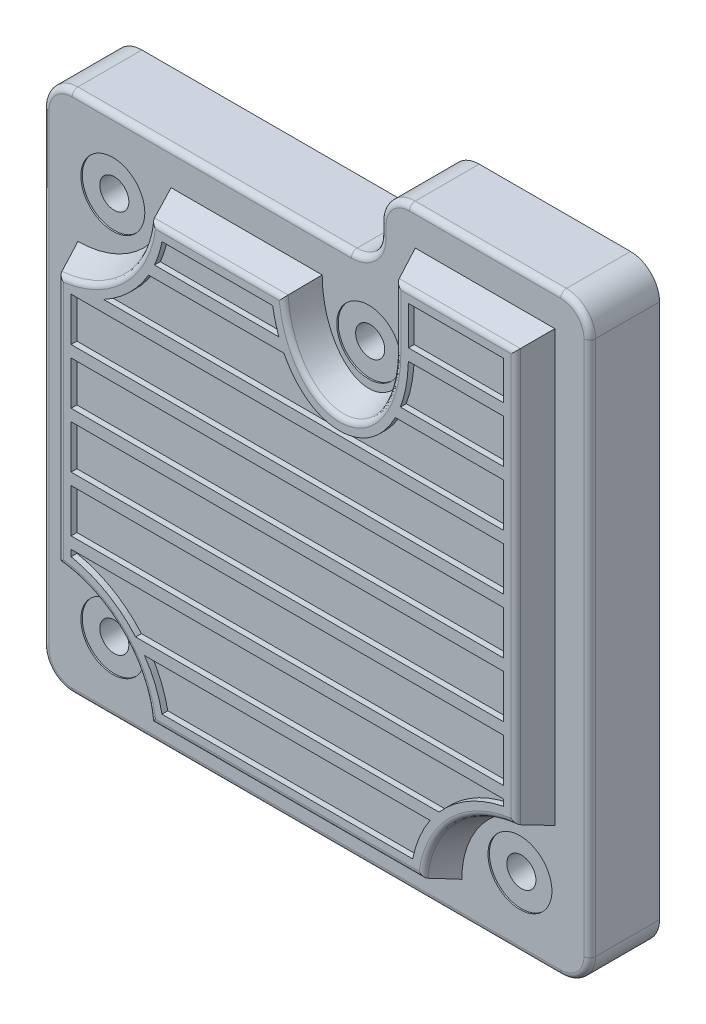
SolidWorks part; units mm, degrees
ref_plane "Plan de face" through (0, 0, 0) normal (0, 0, 1) x (1, 0, 0)
ref_plane "Plan de dessus" through (0, 0, 0) normal (0, 1, 0) x (1, 0, 0)
ref_plane "Plan de droite" through (0, 0, 0) normal (1, 0, 0) x (0, 0, -1)
sketch "Esquisse1" plane through (0, 0, 0) normal (0, 0, 1) x (1, 0, 0)
  line L0 (0, 0) -> (0, 90)
  line L1 (0, 90) -> (58, 90)
  line L2 (58, 90) -> (58, 102)
  line L3 (58, 102) -> (94, 102)
  line L4 (94, 102) -> (94, 0)
  line L5 (94, 0) -> (0, 0)
  dimension "D1" = 94
  dimension "D2" = 36
  dimension "D3" = 90
  dimension "D4" = 102
extrude "Boss.-Extru.1" add sketch "Esquisse1" along normal blind 12
sketch "Esquisse2" plane through (0, 0, 12) normal (0, 0, 1) x (1, 0, 0)
  line L0 (58, 90) -> (0, 90) construction
  line L1 (0, 90) -> (0, 0) construction
  line L2 (0, 0) -> (94, 0) construction
  line L3 (94, 0) -> (94, 102) construction
  circle A0 centre (12, 78) radius 5.5
  circle A1 centre (56, 78) radius 5.5
  circle A2 centre (82, 12) radius 5.5
  circle A3 centre (12, 12) radius 5.5
  dimension "D1" = 11
  dimension "D2" = 12
  dimension "D3" = 12
  dimension "D4" = 12
  dimension "D5" = 12
  dimension "D6" = 12
  dimension "D7" = 12
  dimension "D8" = 12
  dimension "D9" = 44
extrude "Enlèv. mat.-Extru.1" cut sketch "Esquisse2" against normal blind 0.25
sketch "Esquisse3" plane through (0, 0, 12) normal (0, 0, 1) x (1, 0, 0)
  circle A0 centre (12, 78) radius 2.5
  circle A1 centre (56, 78) radius 2.5
  circle A2 centre (82, 12) radius 2.5
  circle A3 centre (12, 12) radius 2.5
  dimension "D1" = 5
extrude "Enlèv. mat.-Extru.2" cut sketch "Esquisse3" against normal up to next
sketch "Esquisse4" plane through (0, 0, 12) normal (0, 0, 1) x (1, 0, 0)
  line L0 (48, 84) -> (22, 84)
  line L1 (6, 68) -> (6, 22)
  line L2 (22, 6) -> (72, 6)
  line L3 (88, 22) -> (88, 96)
  line L4 (88, 96) -> (64, 96)
  line L5 (64, 96) -> (64, 84)
  arc A0 (6, 68) -> (22, 84) centre (6, 84) ccw
  arc A1 (22, 6) -> (6, 22) centre (6, 6) ccw
  arc A2 (88, 22) -> (72, 6) centre (88, 6) ccw
  ellipse E0 centre (56, 84) end of major axis (56, 71.0914) minor radius 8 (48, 84) -> (64, 84) ccw
  point P0 (0, 0)
  point P9 (0, 0)
  point P12 (55, 70.9129)
  point P13 (0, 0)
  point P18 (56, 71.0914)
  dimension "D1" = 32
  dimension "D3" = 32
  dimension "D4" = 32
  dimension "D2" = 16
extrude "Boss.-Extru.2" add sketch "Esquisse4" along normal blind 5 draft 20
sketch "Esquisse5" plane through (0, 0, 17) normal (0, 0, 1) x (1, 0, 0)
  line L12 (9.8199, 64.5517) -> (9.8199, 25.4483)
  line L13 (25.4483, 9.8199) -> (68.5517, 9.8199)
  line L14 (84.1801, 25.4483) -> (84.1801, 92.1801)
  line L15 (84.1801, 92.1801) -> (67.8199, 92.1801)
  line L16 (67.8199, 92.1801) -> (67.8199, 84)
  line L17 (44.4807, 80.1801) -> (25.4483, 80.1801)
  line L18 (9.8199, 64.5517) -> (9.8199, 25.4483)
  line L19 (25.4483, 9.8199) -> (68.5517, 9.8199)
  line L20 (84.1801, 25.4483) -> (84.1801, 92.1801)
  line L21 (84.1801, 92.1801) -> (67.8199, 92.1801)
  line L22 (67.8199, 92.1801) -> (67.8199, 84)
  line L23 (44.4807, 80.1801) -> (25.4483, 80.1801)
  arc A6 (9.8199, 64.5517) -> (25.4483, 80.1801) centre (6, 84) ccw
  arc A7 (25.4483, 9.8199) -> (9.8199, 25.4483) centre (6, 6) ccw
  arc A8 (84.1801, 25.4483) -> (68.5517, 9.8199) centre (88, 6) ccw
  arc A9 (9.8199, 64.5517) -> (25.4483, 80.1801) centre (6, 84) ccw
  arc A10 (25.4483, 9.8199) -> (9.8199, 25.4483) centre (6, 6) ccw
  arc A11 (84.1801, 25.4483) -> (68.5517, 9.8199) centre (88, 6) ccw
  spline S2 degree 3 poles (-2824.3667, 861.4988) (-436.7816, 356.2799) (77.4702, 173.721) (67.5936, 80.5699) (67.4587, 79.7259) (67.0934, 78.0542) (66.8631, 77.2266) (66.4348, 75.9995) (66.2782, 75.5933) (65.9397, 74.7979) (65.7573, 74.4073) (65.1678, 73.2582) (64.719, 72.5223) (63.9424, 71.4742) (63.6676, 71.1366) (63.0901, 70.4946) (62.7866, 70.1891) (62.1472, 69.6117) (61.8113, 69.3398) (61.103, 68.8341) (60.7326, 68.6021) (59.9723, 68.1918) (59.5805, 68.0119) (58.974, 67.7825) (58.7687, 67.7128) (58.3515, 67.5877) (58.1392, 67.5323) (57.0791, 67.2961) (56.221, 67.2312) (55.1354, 67.3117) (54.9173, 67.3361) (54.487, 67.4002) (54.2741, 67.44) (53.6413, 67.5816) (53.2278, 67.7061) (52.4167, 68.013) (52.0173, 68.1967) (51.2541, 68.61) (50.8878, 68.8402) (50.1838, 69.3438) (49.8447, 69.6183) (49.1987, 70.2031) (48.8945, 70.5107) (48.0315, 71.4733) (47.5218, 72.1679) (46.8401, 73.2764) (46.627, 73.6573) (46.2333, 74.4269) (46.0516, 74.8173) (45.548, 76.0037) (45.267, 76.8149) (30.1361, 130.7338) (213.326, 268.8731) (411.1343, -2891.8776) knots -6.71053 -6.71053 -6.71053 -6.71053 0.0625 0.0625 0.125 0.125 0.1875 0.1875 0.21875 0.21875 0.25 0.25 0.3125 0.3125 0.34375 0.34375 0.375 0.375 0.40625 0.40625 0.4375 0.4375 0.46875 0.46875 0.484375 0.484375 0.5 0.5 0.5625 0.5625 0.578125 0.578125 0.59375 0.59375 0.625 0.625 0.65625 0.65625 0.6875 0.6875 0.71875 0.71875 0.75 0.75 0.8125 0.8125 0.84375 0.84375 0.875 0.875 0.9375 0.9375 4.940155 4.940155 4.940155 4.940155 only from (67.8199, 84) to (44.4807, 80.1801)
  spline S3 degree 3 poles (67.8199, 84) (67.8199, 83.1327) (67.7742, 82.2733) (67.5936, 80.5699) (67.4587, 79.7259) (67.0934, 78.0542) (66.8631, 77.2266) (66.4348, 75.9995) (66.2782, 75.5933) (65.9397, 74.7979) (65.7573, 74.4073) (65.1678, 73.2582) (64.719, 72.5223) (63.9424, 71.4742) (63.6676, 71.1366) (63.0901, 70.4946) (62.7866, 70.1891) (62.1472, 69.6117) (61.8113, 69.3398) (61.103, 68.8341) (60.7326, 68.6021) (59.9723, 68.1918) (59.5805, 68.0119) (58.974, 67.7825) (58.7687, 67.7128) (58.3515, 67.5877) (58.1392, 67.5323) (57.0791, 67.2961) (56.221, 67.2312) (55.1354, 67.3117) (54.9173, 67.3361) (54.487, 67.4002) (54.2741, 67.44) (53.6413, 67.5816) (53.2278, 67.7061) (52.4167, 68.013) (52.0173, 68.1967) (51.2541, 68.61) (50.8878, 68.8402) (50.1838, 69.3438) (49.8447, 69.6183) (49.1987, 70.2031) (48.8945, 70.5107) (48.0315, 71.4733) (47.5218, 72.1679) (46.8401, 73.2764) (46.627, 73.6573) (46.2333, 74.4269) (46.0516, 74.8173) (45.548, 76.0037) (45.267, 76.8149) (44.8017, 78.4729) (44.6174, 79.3226) (44.4807, 80.1801) knots 0 0 0 0 0.0625 0.0625 0.125 0.125 0.1875 0.1875 0.21875 0.21875 0.25 0.25 0.3125 0.3125 0.34375 0.34375 0.375 0.375 0.40625 0.40625 0.4375 0.4375 0.46875 0.46875 0.484375 0.484375 0.5 0.5 0.5625 0.5625 0.578125 0.578125 0.59375 0.59375 0.625 0.625 0.65625 0.65625 0.6875 0.6875 0.71875 0.71875 0.75 0.75 0.8125 0.8125 0.84375 0.84375 0.875 0.875 0.9375 0.9375 1 1 1 1
  dimension "D1" = 2
extrude "Enlèv. mat.-Extru.3" cut sketch "Esquisse5" against normal blind 1
sketch "Esquisse7" plane through (0, 0, 16) normal (0, 0, 1) x (1, 0, 0)
  line L0 (9.8199, 64.5517) -> (84.1801, 64.5517)
  line L1 (84.1801, 25.4483) -> (84.1801, 92.1801) construction
  line L2 (84.1801, 66.5517) -> (84.1801, 64.5517)
  line L3 (84.1801, 66.5517) -> (15.4013, 66.5517)
  line L4 (9.8199, 57.0517) -> (84.1801, 57.0517)
  line L6 (84.1801, 55.0517) -> (9.8199, 55.0517)
  line L9 (9.8199, 57.0517) -> (9.8199, 55.0517)
  line L10 (9.8199, 64.5517) -> (9.8199, 25.4483)
  line L11 (25.4483, 9.8199) -> (68.5517, 9.8199)
  line L12 (84.1801, 25.4483) -> (84.1801, 92.1801)
  line L13 (84.1801, 92.1801) -> (67.8199, 92.1801)
  line L14 (67.8199, 92.1801) -> (67.8199, 84)
  line L15 (44.4807, 80.1801) -> (25.4483, 80.1801)
  line L18 (84.1801, 55.0517) -> (84.1801, 57.0517)
  line L22 (9.8199, 64.5517) -> (9.8199, 25.4483) construction
  line L23 (9.8199, 47.5517) -> (84.1801, 47.5517)
  line L24 (84.1801, 47.5517) -> (84.1801, 45.5517)
  line L25 (84.1801, 45.5517) -> (9.8199, 45.5517)
  line L26 (9.8199, 45.5517) -> (9.8199, 47.5517)
  line L28 (9.8199, 38.0517) -> (84.1801, 38.0517)
  line L29 (9.8199, 64.5517) -> (9.8199, 25.4483) construction
  line L30 (84.1801, 25.4483) -> (84.1801, 92.1801) construction
  line L31 (84.1801, 38.0517) -> (84.1801, 36.0517)
  line L32 (84.1801, 36.0517) -> (9.8199, 36.0517)
  line L33 (9.8199, 36.0517) -> (9.8199, 38.0517)
  line L35 (9.8199, 28.5517) -> (84.1801, 28.5517)
  line L36 (84.1801, 28.5517) -> (84.1801, 26.5517)
  line L37 (84.1801, 26.5517) -> (9.8199, 26.5517)
  line L38 (9.8199, 26.5517) -> (9.8199, 28.5517)
  line L39 (23.1423, 74.0517) -> (46.4252, 74.0517)
  line L40 (24.1563, 76.0517) -> (45.5506, 76.0517)
  line L41 (65.5748, 74.0517) -> (84.1801, 74.0517)
  line L42 (66.4493, 76.0517) -> (84.1801, 76.0517)
  line L43 (67.8199, 85.5517) -> (84.1801, 85.5517)
  line L44 (67.8158, 83.5517) -> (84.1801, 83.5517)
  line L45 (84.1801, 76.0517) -> (84.1801, 74.0517)
  line L46 (84.1801, 85.5517) -> (84.1801, 83.5517)
  line L47 (67.8199, 92.1801) -> (67.8199, 84) construction
  line L48 (67.8199, 85.5517) -> (67.8199, 84)
  line L49 (20.9157, 19.0517) -> (73.0843, 19.0517)
  line L50 (22.4525, 17.0517) -> (71.5475, 17.0517)
  arc A3 (25.4483, 9.8199) -> (9.8199, 25.4483) centre (6, 6) ccw construction
  arc A4 (9.8199, 64.5517) -> (25.4483, 80.1801) centre (6, 84) ccw
  arc A5 (25.4483, 9.8199) -> (9.8199, 25.4483) centre (6, 6) ccw
  arc A6 (84.1801, 25.4483) -> (68.5517, 9.8199) centre (88, 6) ccw
  arc A7 (9.8199, 64.5517) -> (15.4013, 66.5517) centre (6, 84) ccw
  arc A9 (23.1423, 74.0517) -> (24.1563, 76.0517) centre (6, 84) ccw
  arc A10 (84.1801, 25.4483) -> (68.5517, 9.8199) centre (88, 6) ccw construction
  arc A11 (22.4525, 17.0517) -> (20.9157, 19.0517) centre (6, 6) ccw
  arc A12 (73.0843, 19.0517) -> (71.5475, 17.0517) centre (88, 6) ccw
  spline S1 degree 3 poles (-873.6593, 421.0682) (-127.7024, 233.4153) (73.8451, 139.5308) (67.5936, 80.5699) (67.4587, 79.7259) (67.0934, 78.0542) (66.8631, 77.2266) (66.4348, 75.9995) (66.2782, 75.5933) (65.9397, 74.7979) (65.7573, 74.4073) (65.1678, 73.2582) (64.719, 72.5223) (63.9424, 71.4742) (63.6676, 71.1366) (63.0901, 70.4946) (62.7866, 70.1891) (62.1472, 69.6117) (61.8113, 69.3398) (61.103, 68.8341) (60.7326, 68.6021) (59.9723, 68.1918) (59.5805, 68.0119) (58.974, 67.7825) (58.7687, 67.7128) (58.3515, 67.5877) (58.1392, 67.5323) (57.0791, 67.2961) (56.221, 67.2312) (55.1354, 67.3117) (54.9173, 67.3361) (54.487, 67.4002) (54.2741, 67.44) (53.6413, 67.5816) (53.2278, 67.7061) (52.4167, 68.013) (52.0173, 68.1967) (51.2541, 68.61) (50.8878, 68.8402) (50.1838, 69.3438) (49.8447, 69.6183) (49.1987, 70.2031) (48.8945, 70.5107) (48.0315, 71.4733) (47.5218, 72.1679) (46.8401, 73.2764) (46.627, 73.6573) (46.2333, 74.4269) (46.0516, 74.8173) (45.548, 76.0037) (45.267, 76.8149) (34.4337, 115.4194) (124.1224, 196.2542) (248.0068, -898.8888) knots -4.201614 -4.201614 -4.201614 -4.201614 0.0625 0.0625 0.125 0.125 0.1875 0.1875 0.21875 0.21875 0.25 0.25 0.3125 0.3125 0.34375 0.34375 0.375 0.375 0.40625 0.40625 0.4375 0.4375 0.46875 0.46875 0.484375 0.484375 0.5 0.5 0.5625 0.5625 0.578125 0.578125 0.59375 0.59375 0.625 0.625 0.65625 0.65625 0.6875 0.6875 0.71875 0.71875 0.75 0.75 0.8125 0.8125 0.84375 0.84375 0.875 0.875 0.9375 0.9375 3.785541 3.785541 3.785541 3.785541 only from (67.8199, 84) to (44.4807, 80.1801)
  spline S2 degree 3 poles (67.8199, 84) (67.8199, 83.8503) (67.8185, 83.7009) (67.8158, 83.5517) knots 0 0 0 0 0.010785 0.010785 0.010785 0.010785
  spline S3 degree 3 poles (66.4493, 76.0517) (66.3425, 75.7634) (66.2289, 75.4773) (65.9437, 74.8074) (65.766, 74.4259) (65.5748, 74.0517) knots 0.196608 0.196608 0.196608 0.196608 0.21875 0.21875 0.249253 0.249253 0.249253 0.249253
  spline S4 degree 3 poles (46.4252, 74.0517) (46.2302, 74.4334) (46.0502, 74.8206) (45.7661, 75.49) (45.6551, 75.7697) (45.5506, 76.0517) knots 0.844011 0.844011 0.844011 0.844011 0.875 0.875 0.896904 0.896904 0.896904 0.896904
  point P66 (0, 0)
  point P67 (0, 0)
  point P68 (0, 0)
  point P69 (0, 0)
  dimension "D2" = 2
  dimension "D3" = 7.5
  dimension "D4" = 2
  dimension "D5" = 2
  dimension "D6" = 2
  dimension "D7" = 2
  dimension "D8" = 7.5
  dimension "D9" = 7.5
  dimension "D10" = 7.5
  dimension "D11" = 2
  dimension "D12" = 7.5
  dimension "D13" = 2
  dimension "D14" = 2
  dimension "D15" = 7.5
  dimension "D16" = 7.5
  dimension "D17" = 2
  dimension "D18" = 7.5
  dimension "D1" = 0
extrude "Boss.-Extru.3" add sketch "Esquisse7" along normal up to surface (1 mm away)
fillet "Congé2" radius 5 6 edges at (94, 0, 6) (0, 0, 6) (94, 102, 6) (58, 102, 6) (58, 90, 6) (0, 90, 6)
fillet "Congé3" radius 1 22 edges at (1.4645, 1.4645, 12) (0, 45, 12) (1.4645, 88.5355, 12) (29, 90, 12) (56.5355, 91.4645, 12) (58, 96, 12) (59.4645, 100.5355, 12) (76, 102, 12) (92.5355, 100.5355, 12) (94, 51, 12) (92.5355, 1.4645, 12) (47, 0, 12) (65.8199, 89.0901, 17) (76, 94.1801, 17) (55.3685, 69.3012, 17) (34.9902, 82.1801, 17) (18.6005, 71.3995, 17) (7.8199, 45, 17) (18.6005, 18.6005, 17) (47, 7.8199, 17) (75.3995, 18.6005, 17) (86.1801, 58.9534, 17)
shell "Coque5" thickness 1
